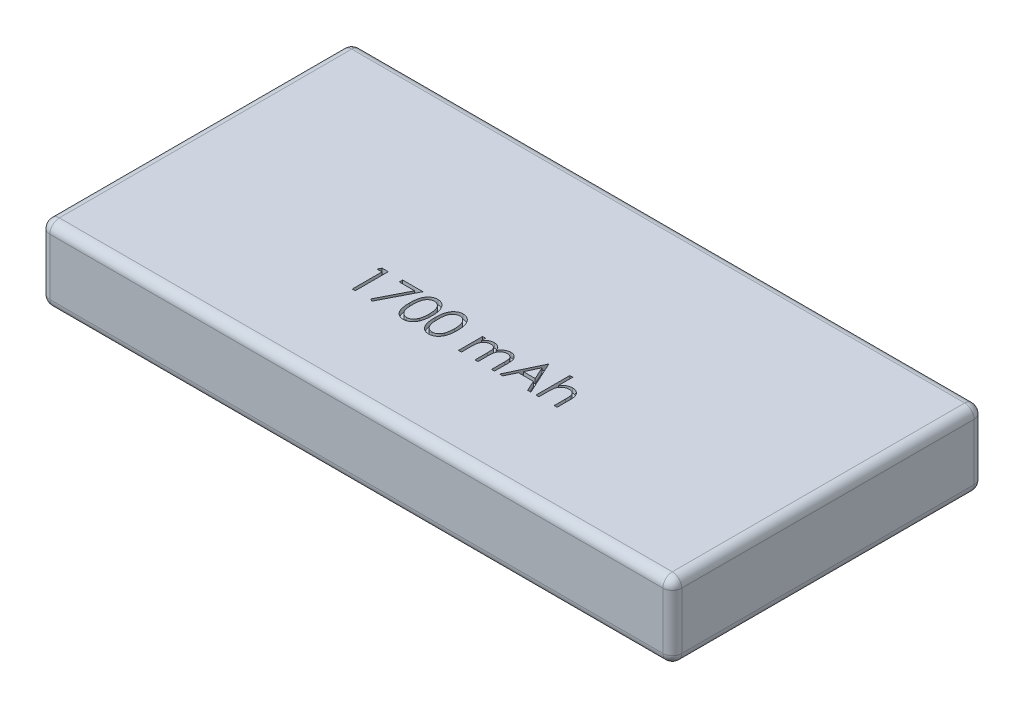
SolidWorks part; units mm, degrees
ref_plane "Front Plane" through (0, 0, 0) normal (0, 0, 1) x (1, 0, 0)
ref_plane "Top Plane" through (0, 0, 0) normal (0, 1, 0) x (1, 0, 0)
ref_plane "Right Plane" through (0, 0, 0) normal (1, 0, 0) x (0, 0, -1)
sketch "Sketch1" plane through (0, 0, 0) normal (0, 1, 0) x (1, 0, 0)
  line L1 (0, 0) -> (67, 0)
  line L2 (0, 0) -> (0, 33)
  line L3 (0, 33) -> (67, 33)
  line L4 (67, 0) -> (67, 33)
  dimension "D1" = 67
  dimension "D2" = 33
extrude "Boss-Extrude1" add sketch "Sketch1" along normal blind 8
fillet "Fillet1" radius 1 12 edges at (33.5, 0, 0) (67, 0, -16.5) (33.5, 0, -33) (0, 0, -16.5) (33.5, 8, -33) (67, 8, -16.5) (33.5, 8, 0) (0, 8, -16.5) (0, 4, -33) (67, 4, -33) (67, 4, 0) (0, 4, 0)
sketch "Sketch2" plane through (0, 8, 0) normal (0, 1, 0) x (1, 0, 0)
  line L0 (1, 10) -> (66, 10) construction
  line L1 (1, 32) -> (1, 1) construction
  line L2 (66, 1) -> (66, 32) construction
  line L3 (66, 0) -> (1, 0) construction
  text T0 "1700 mAh"
  dimension "D1" = 10
extrude "Cut-Extrude1" cut sketch "Sketch2" against normal blind 0.5
